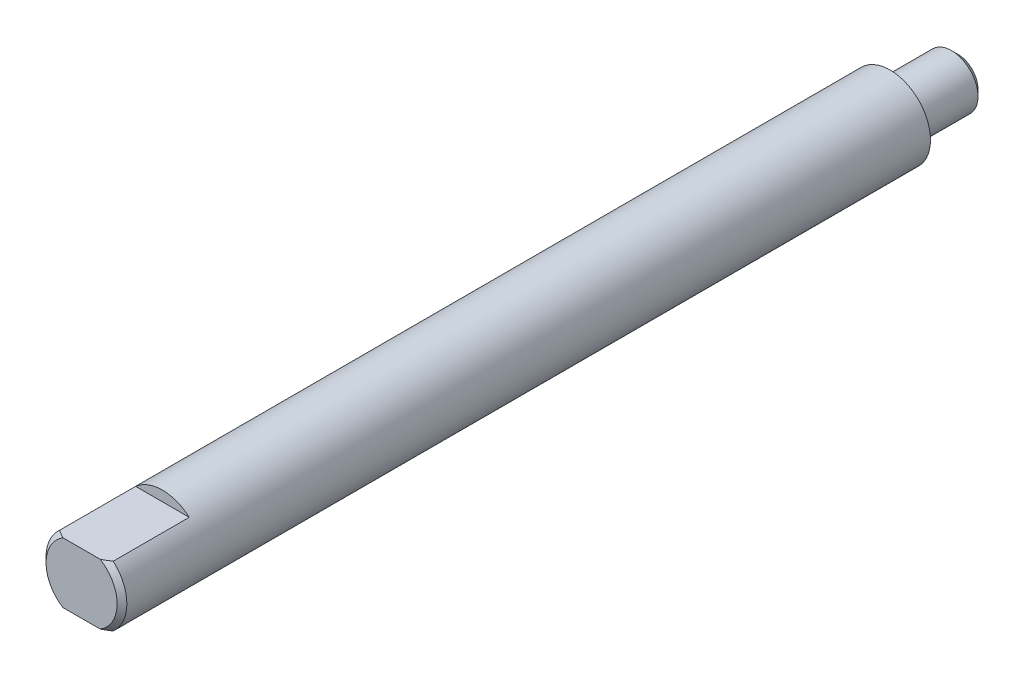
SolidWorks part; units mm, degrees
ref_plane "Front" through (0, 0, 0) normal (0, 0, 1) x (1, 0, 0)
ref_plane "Top" through (0, 0, 0) normal (0, 1, 0) x (1, 0, 0)
ref_plane "Right" through (0, 0, 0) normal (1, 0, 0) x (0, 0, -1)
sketch "Sketch1" plane through (0, 0, 0) normal (1, 0, 0) x (0, 0, -1)
  line L0 (64.77, 1.57) -> (64.26, 2.0828)
  line L1 (-4.064, 0) -> (64.77, 0)
  line L2 (-4.064, 0) -> (-4.064, 2.79)
  line L3 (-3.684, 3.175) -> (59.436, 3.175)
  line L4 (59.436, 2.0828) -> (59.436, 3.175)
  line L5 (153.7208, 0) -> (-49846.2792, 0) construction
  line L6 (-4.064, 2.79) -> (-3.684, 3.175)
  line L7 (59.436, 2.0828) -> (64.26, 2.0828)
  line L8 (64.77, 0) -> (64.77, 1.57)
  point P2 (0, 0)
  point P12 (-11.2277, 7.5431)
  dimension "D1" = 63.5
  dimension "D2" = 3.175
  dimension "D3" = 4.1656
  dimension "D4" = 5.334
  dimension "D5" = 1.57
  dimension "D6" = 0.51
  dimension "D7" = 2.79
  dimension "D8" = 0.38
  dimension "D9" = 4.064
revolve "Revolve1" add sketch "Sketch1" angle 360 about L1
sketch "Sketch2" plane through (0, 0, 0) normal (1, 0, 0) x (0, 0, -1)
  line L0 (-4.064, 2.79) -> (-4.064, -2.79) construction
  line L1 (-4.064, 2.375) -> (2.286, 2.375)
  line L2 (-4.064, 2.375) -> (-4.064, 3.175)
  line L3 (-4.064, 3.175) -> (2.286, 3.175)
  line L4 (2.286, 2.375) -> (2.286, 3.175)
  line L5 (59.436, 3.175) -> (-3.684, 3.175) construction
  line L6 (0, 0) -> (6.0811, 0) construction
  line L7 (2.286, -2.375) -> (2.286, -3.175)
  line L8 (-4.064, -3.175) -> (2.286, -3.175)
  line L9 (-4.064, -2.375) -> (-4.064, -3.175)
  line L10 (-4.064, -2.375) -> (2.286, -2.375)
  dimension "D1" = 0.8
  dimension "D2" = 6.35
extrude "Cut-Extrude1" cut sketch "Sketch2" against normal mid plane 10
